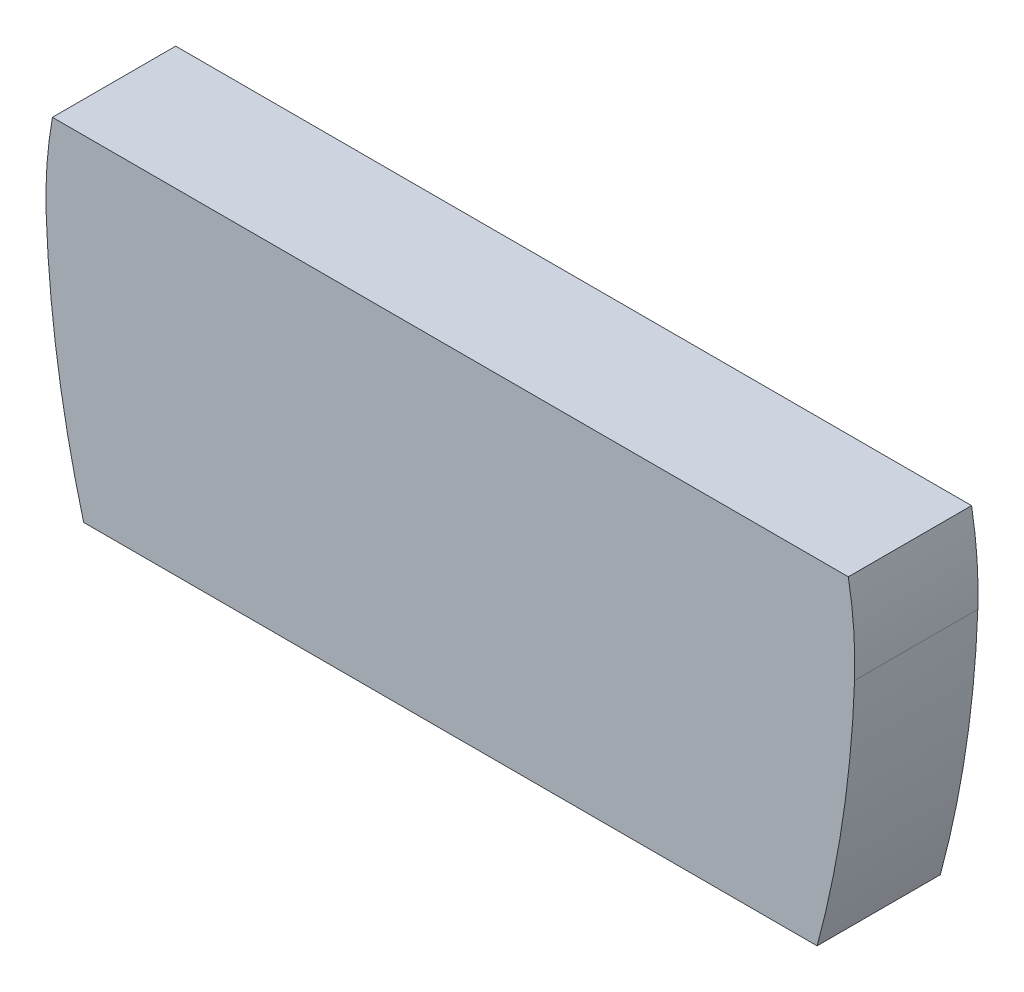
SolidWorks part; units mm, degrees
ref_plane "Ebene vorne" through (0, 0, 0) normal (0, 0, 1) x (1, 0, 0)
ref_plane "Ebene oben" through (0, 0, 0) normal (0, 1, 0) x (1, 0, 0)
ref_plane "Ebene rechts" through (0, 0, 0) normal (1, 0, 0) x (0, 0, -1)
ref_plane "Ebene1" through (0, 0, -5.5) normal (0, 0, 1) x (1, 0, 0)
sketch "Skizze35" plane through (0, 0, -107.7276) normal (0, 0, 1) x (1, 0, 0)
  line L3 (-16.2759, 23.2381) -> (16.2759, 23.2381)
  line L4 (-17.6614, 38.1175) -> (17.6614, 38.1175)
  arc A6 (17.9385, 34.2684) -> (17.6614, 38.1175) centre (0, 34.9116) ccw
  arc A8 (16.2759, 23.2381) -> (17.9385, 34.2684) centre (-31.165, 36.0291) ccw
  arc A10 (-17.9385, 34.2684) -> (-16.2759, 23.2381) centre (31.165, 36.0291) ccw
  arc A11 (-17.6614, 38.1175) -> (-17.9385, 34.2684) centre (0, 34.9116) ccw
extrude "Linear austragen1" add sketch "Skizze35" against normal blind 5.47
ref_plane "Ebene8" through (-14.3894, -1.3399, -0.0537) normal (0.9957, 0.0927, 0.0037) x (0.0037, 0.0003, -1)
sketch "Skizze37" plane through (-14.3894, -1.3399, -0.0537) normal (0.9957, 0.0927, 0.0037) x (0.0037, 0.0003, -1)
  line L0 (107.6746, 24.647) -> (100.8647, 24.6494)
ref_plane "Ebene9" through (14.3894, -1.3399, -0.0537) normal (0.9957, -0.0927, -0.0037) x (-0.0037, 0.0003, -1)
sketch "Skizze38" plane through (14.3894, -1.3399, -0.0537) normal (0.9957, -0.0927, -0.0037) x (-0.0037, 0.0003, -1)
  line L0 (100.8647, 24.6494) -> (107.6746, 24.647)
sketch "Skizze44" plane through (-14.1377, 24.4873, 0) normal (-0.5, 0.866, 0) x (0.866, 0.5, 0)
  line L1 (16.3248, 100.9178) -> (-2.4983, 100.9178)
ref_plane "Ebene10" through (17.3859, -30.1133, -69.2692) normal (-0.2243, 0.3885, 0.8937) x (0.9745, 0.0894, 0.2057)
sketch "rechts" plane through (17.3859, -30.1133, -69.2692) normal (-0.2243, 0.3885, 0.8937) x (0.9745, 0.0894, 0.2057)
  line L1 (-17.8406, 70.177) -> (-34.5682, 61.5457)
  line L2 (-34.5682, 61.5457) -> (-35.9638, 77.9064) construction
  line L3 (-34.5682, 61.5457) -> (-35.9638, 77.9064)
  line L4 (-35.9638, 77.9064) -> (-1.5411, 77.9064) construction
  line L5 (-35.9638, 77.9064) -> (-17.8406, 77.9064)
  line L6 (-17.8406, 70.177) -> (-34.5682, 61.5457)
  line L7 (-17.8406, 70.177) -> (-17.8406, 77.9064)
sketch "Skizze46" plane through (14.1377, 24.4873, 0) normal (0.5, 0.866, 0) x (0.866, -0.5, 0)
  line L0 (-16.3248, 100.9178) -> (2.4983, 100.9178)
ref_plane "Ebene11" through (-17.3859, -30.1133, -69.2692) normal (0.2243, 0.3885, 0.8937) x (0.9745, -0.0894, -0.2057)
sketch "links" plane through (-17.3859, -30.1133, -69.2692) normal (0.2243, 0.3885, 0.8937) x (0.9745, -0.0894, -0.2057)
  line L0 (17.8406, 70.177) -> (34.5682, 61.5457) construction
  line L1 (17.8406, 70.177) -> (34.5682, 61.5457)
  line L2 (17.8406, 70.177) -> (17.8406, 77.9064) construction
  line L3 (17.8406, 70.177) -> (17.8406, 77.9064)
  line L4 (34.5682, 61.5457) -> (35.9638, 77.9064) construction
  line L5 (34.5682, 61.5457) -> (35.9638, 77.9064)
  line L6 (17.8406, 77.9064) -> (35.9638, 77.9064)
ref_plane "Ebene12" through (14.3894, -1.3399, -0.0537) normal (-0.9957, 0.0927, 0.0037) x (0.0037, -0.0003, 1)
sketch "Skizze49" plane through (14.3894, -1.3399, -0.0537) normal (-0.9957, 0.0927, 0.0037) x (0.0037, -0.0003, 1)
  line L0 (-100.8647, 24.6494) -> (-107.6746, 24.647)
ref_plane "Ebene13" through (0, 23.2381, 0) normal (0, -1, 0) x (1, 0, 0)
sketch "Skizze51" plane through (0, 23.2381, 0) normal (0, -1, 0) x (1, 0, 0)
  line L0 (-16.3013, -100.9178) -> (16.3014, -100.9178)
sketch "Skizze52" plane through (0, 23.2381, 0) normal (0, -1, 0) x (1, 0, 0)
  line L0 (-16.2759, -107.7276) -> (-16.3013, -100.9178) construction
  line L1 (-16.2759, -107.7276) -> (-16.3013, -100.9178)
  line L2 (-16.3013, -100.9178) -> (16.3014, -100.9178) construction
  line L3 (-16.3013, -100.9178) -> (16.3014, -100.9178)
  line L4 (16.3014, -100.9178) -> (16.2759, -107.7276) construction
  line L5 (16.3014, -100.9178) -> (16.2759, -107.7276)
  line L6 (-16.2759, -107.7276) -> (16.2759, -107.7276) construction
  line L7 (-16.2759, -107.7276) -> (16.2759, -107.7276)
